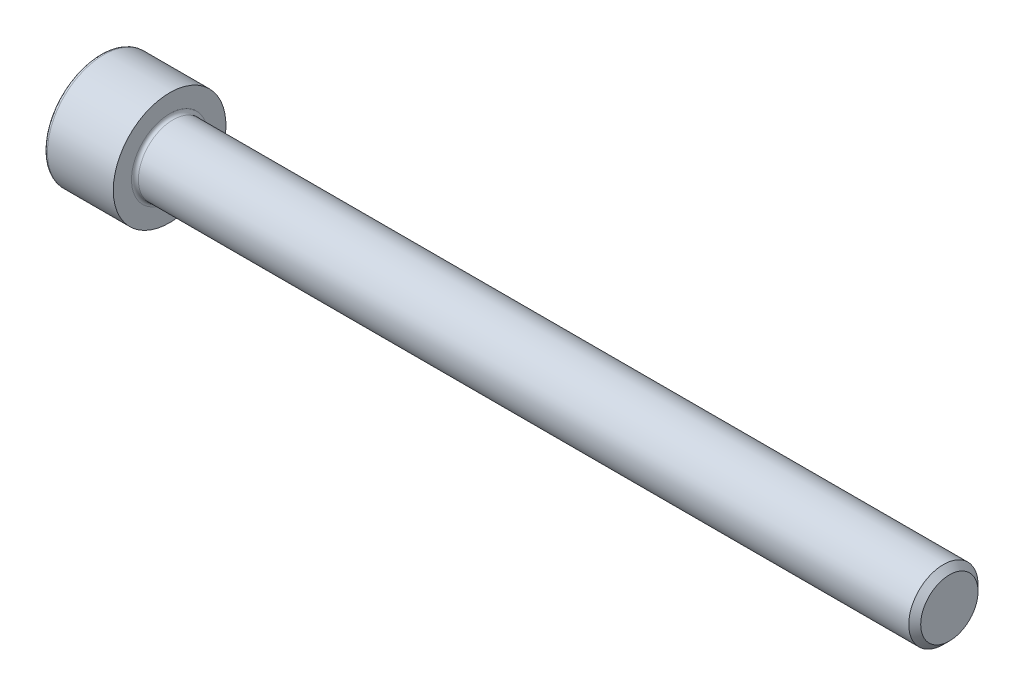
SolidWorks part; units mm, degrees
revolve "Base-Revolve" add sketch "BodySke"
sketch "BodySke" plane through (0, 0, 0) normal (0, 0, 1) x (1, 0, 0)
  line L0 (0, 0) -> (0, 6.5)
  line L1 (0, 6.5) -> (8, 6.5)
  line L2 (8, 6.5) -> (8, 4)
  line L3 (8, 4) -> (97.3095, 4)
  line L4 (98, 3.3095) -> (98, 0)
  line L5 (98, 0) -> (0, 0)
  line L6 (-31.75, 0) -> (127, 0) construction
  line L8 (98, 3.3095) -> (97.3095, 4)
  line L10 (98, -3.3095) -> (97.3095, -4) construction
  line L11 (9.25, 9.525) -> (9.25, 3.175) construction
  line L12 (70, 9.525) -> (70, 3.175) construction
  line L13 (38, 9.525) -> (38, 3.175) construction
fillet "Fillet1" radius 0.4 1 edges at (8, 0, 4)
fillet "Fillet2" radius 0.4 1 edges at (0, 0, 6.5)
ref_plane "Plane1" through (0, 0, 0) normal (0, 0, 1) x (1, 0, 0)
ref_plane "Plane2" through (0, 0, 0) normal (0, 1, 0) x (1, 0, 0)
ref_plane "Plane3" through (0, 0, 0) normal (1, 0, 0) x (0, 0, -1)
other "Configuration Table"
sketch "Sketch2" plane through (0, 0, 0) normal (0, 0, 1) x (1, 0, 0)
  line L0 (0, 3.0475) -> (4, 3.0475)
  line L1 (4, 3.0475) -> (5.7595, 0)
  line L2 (-31.75, 0) -> (127, 0) construction
  line L3 (5.7595, 0) -> (0, 0)
  line L4 (0, 0) -> (0, 3.0475)
  line L6 (0, 0) -> (47.625, 0) construction
revolve "Hex-PreBroach" cut sketch "Sketch2" angle 360 about L6
sketch "Sketch3" plane through (0, 0, 0) normal (-1, 0, 0) x (0, 0.5, 0.866)
  line L0 (1.7595, 3.0475) -> (-1.7595, 3.0475)
  line L1 (-1.7595, 3.0475) -> (-3.5189, 0)
  line L2 (1.7595, 3.0475) -> (3.5189, 0)
  line L3 (1.7595, -3.0475) -> (3.5189, 0)
  line L4 (1.7595, -3.0475) -> (-1.7595, -3.0475)
  line L5 (-1.7595, -3.0475) -> (-3.5189, 0)
extrude "Hex" cut sketch "Sketch3" against normal blind 4
sketch "ThdSchSke" plane through (0, 0, 0) normal (0, 0, 1) x (1, 0, 0)
  line L0 (70, -3.3095) -> (69.5165, -4)
  line L1 (70, -3.3095) -> (70.4835, -4)
  line L2 (70.4835, -4) -> (70.4835, -5)
  line L3 (-3.175, 0) -> (5.1513, 0) construction
  line L4 (0, 6.1) -> (0, -6.1) construction
  line L5 (70.4835, -5) -> (69.5165, -5)
  line L6 (69.5165, -5) -> (69.5165, -4)
revolve "ThreadSchematic" [suppressed] cut sketch "ThdSchSke" angle 360 about L3
pattern_linear "ThdSchPat" [suppressed]
equation "\"D2@Sketch3\" = \"Hex_size@Sketch3\" / 2"
equation "\"D1@Sketch3\" = \"Hex_size@Sketch3\" / 2"
equation "\"D1@Sketch2\" = \"Hex_size@Sketch3\" / 2"
equation "\"Thread_minor@ThreadCosmetic\"  =  \"Minor_dia@BodySke\""
equation "\"Depth@Sketch2\" =  \"Key_eng@Hex\""
equation "\"Thread_length@ThreadCosmetic\" = ((sgn( (\"Length@BodySke\" - \"Advance@BodySke\" * 3.0) - \"Thread_nom@BodySke\" )-1)*( (\"Length@BodySke\" - \"Advance@BodySke\" * 3.0) - \"Thread_nom@BodySke\" ))/-2+ \"Thread_no"
equation "\"Thread_minor@ThdSchSke\" = \"Minor_dia@BodySke\""
equation "\"Diameter@ThdSchSke\" = \"Diameter@BodySke\""
equation "\"Overcut@ThdSchSke\" = \"Diameter@BodySke\" * 1.25"
equation "\"Start@ThdSchSke\" = \"Head_ht@BodySke\" + \"Length@BodySke\" - \"Thread_length@ThreadCosmetic\"  '---Non-countersunk---"
equation "\"Num_threads@ThdSchPat\" = int( \"Thread_length@ThreadCosmetic\" / \"Advance@BodySke\" + 0.999 )  + 1"
equation "\"Advance@ThdSchPat\" = \"Thread_length@ThreadCosmetic\" /  (\"Num_threads@ThdSchPat\" - 1) 'relax it"
equation "\"Num_threads@ThdSchPat\" = \"Num_threads@ThdSchPat\" - sgn( \"Num_threads@ThdSchPat\" - 1) '---chamfered tips only---"
